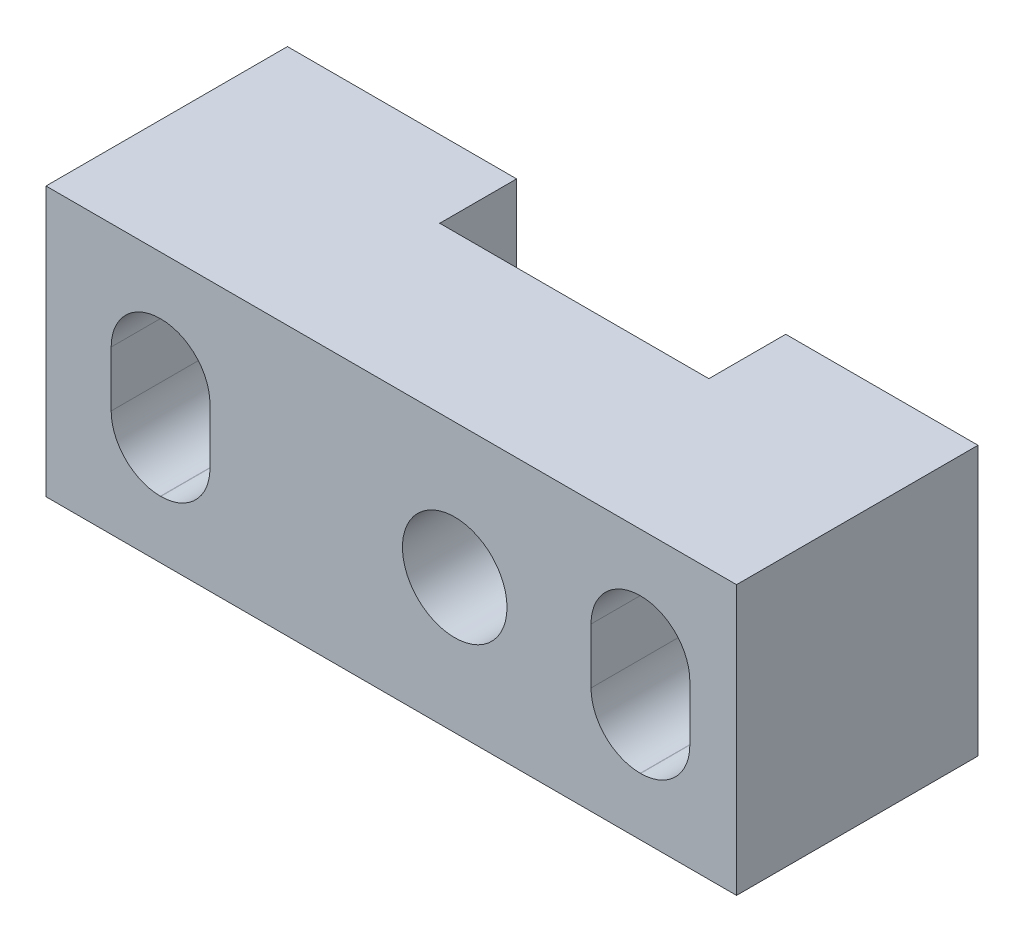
SolidWorks part; units mm, degrees
ref_plane "Front" through (0, 0, 0) normal (0, 0, 1) x (1, 0, 0)
ref_plane "Top" through (0, 0, 0) normal (0, 1, 0) x (1, 0, 0)
ref_plane "Right" through (0, 0, 0) normal (1, 0, 0) x (0, 0, -1)
sketch "Sketch1" plane through (0, 0, 0) normal (0, 0, 1) x (1, 0, 0)
  line L1 (-13.5001, 0) -> (9.3091, 0)
  line L2 (-13.5001, 0) -> (-13.5001, -8.89)
  line L3 (-13.5001, -8.89) -> (9.3091, -8.89)
  line L4 (9.3091, 0) -> (9.3091, -8.89)
  dimension "D1" = 13.5001
  dimension "D2" = 22.8092
  dimension "D3" = 8.89
extrude "Extrude1" add sketch "Sketch1" along normal blind 7.9756
sketch "Sketch2" plane through (0, 0, 0) normal (0, 0, -1) x (-1, 0, 0)
  line L0 (13.5001, -8.89) -> (-9.3091, -8.89) construction
  line L1 (-2.9591, -8.89) -> (5.9309, -8.89)
  line L2 (-2.9591, -8.89) -> (-2.9591, 0)
  line L3 (-2.9591, 0) -> (5.9309, 0)
  line L4 (5.9309, -8.89) -> (5.9309, 0)
  line L5 (-9.3091, 0) -> (13.5001, 0) construction
  line L6 (-9.3091, -8.89) -> (-9.3091, 0) construction
  dimension "D1" = 6.35
  dimension "D2" = 8.89
hole_wizard "#8-32 Tapped Hole1" positions "Sketch4" profile "Sketch3" tap size "#8-32" standard "Ansi Inch"
sketch "Sketch4" plane through (0, 0, 7.9756) normal (0, 0, 1) x (1, 0, 0)
  line L0 (0, 0) -> (0, -8.89) construction
  line L1 (-13.5001, -8.89) -> (9.3091, -8.89) construction
  line L2 (9.3091, 0) -> (-13.5001, 0) construction
  point P0 (0, -4.445)
  dimension "D1" = 4.445
sketch "Sketch3" plane through (0, -4.445, 7.9756) normal (1, 0, 0) x (0, -1, 0)
  line L0 (0, 0) -> (0, 8.7274)
  line L1 (0, 8.7274) -> (1.7272, 8.7274)
  line L2 (1.7272, 8.7274) -> (1.7272, 0)
  line L5 (1.7272, 0) -> (0, 0)
  line L10 (0, 8.7274) -> (-1.7272, 8.7274) construction
  line L11 (0, -6.35) -> (0, 107.95) construction
  dimension "Tap Drill Dia." = 3.4544
  dimension "Tap Drill Depth" = 8.7274
  dimension "Drill Angle" = 180
extrude "Cut-Extrude1" cut sketch "Sketch2" against normal blind 2.54
sketch "Sketch5" plane through (0, 0, 7.9756) normal (0, 0, 1) x (1, 0, 0)
  line L0 (2.9591, -4.445) -> (9.3091, -4.445) construction
  line L1 (4.5021, -1.905) -> (7.766, -1.905)
  line L2 (4.5021, -1.905) -> (4.5021, -6.985)
  line L3 (4.5021, -6.985) -> (7.766, -6.985)
  line L4 (7.766, -1.905) -> (7.766, -6.985)
  line L5 (2.9591, 0) -> (2.9591, -8.89) construction
  line L6 (9.3091, -8.89) -> (9.3091, 0) construction
  line L7 (6.1341, 0) -> (6.1341, -8.89) construction
  line L8 (-13.5001, -8.89) -> (9.3091, -8.89) construction
  line L9 (9.3091, 0) -> (-13.5001, 0) construction
  line L10 (-13.5001, 0) -> (-13.5001, -8.89) construction
  point P15 (6.1341, -1.905)
  point P18 (4.5021, -4.445)
  dimension "D1" = 3.2639
  dimension "D2" = 1.905
  dimension "D3" = 5.08
  dimension "D4" = 18.0022
extrude "Cut-Extrude2" cut sketch "Sketch5" against normal through all
fillet "Fillet1" radius 1.6256 4 edges at (4.5021, -1.905, 3.9878) (7.766, -1.905, 3.9878) (7.766, -6.985, 3.9878) (4.5021, -6.985, 3.9878)
sketch "Sketch6" plane through (0, 0, 7.9756) normal (0, 0, 1) x (1, 0, 0)
  line L0 (-13.5001, 0) -> (-13.5001, -8.89) construction
  line L1 (-11.3475, -1.905) -> (-8.0836, -1.905)
  line L2 (-11.3475, -1.905) -> (-11.3474, -6.985)
  line L3 (-11.3474, -6.985) -> (-8.0835, -6.985)
  line L4 (-8.0836, -1.905) -> (-8.0835, -6.985)
  line L7 (-13.5001, -8.89) -> (-5.9309, -8.89) construction
  dimension "D1" = 3.2639
  dimension "D2" = 2.1526
  dimension "D3" = 1.905
extrude "Cut-Extrude3" cut sketch "Sketch6" against normal through all
fillet "Fillet2" radius 1.6256 4 edges at (-11.3474, -6.985, 3.9878) (-8.0835, -6.985, 3.9878) (-8.0836, -1.905, 3.9878) (-11.3475, -1.905, 3.9878)
